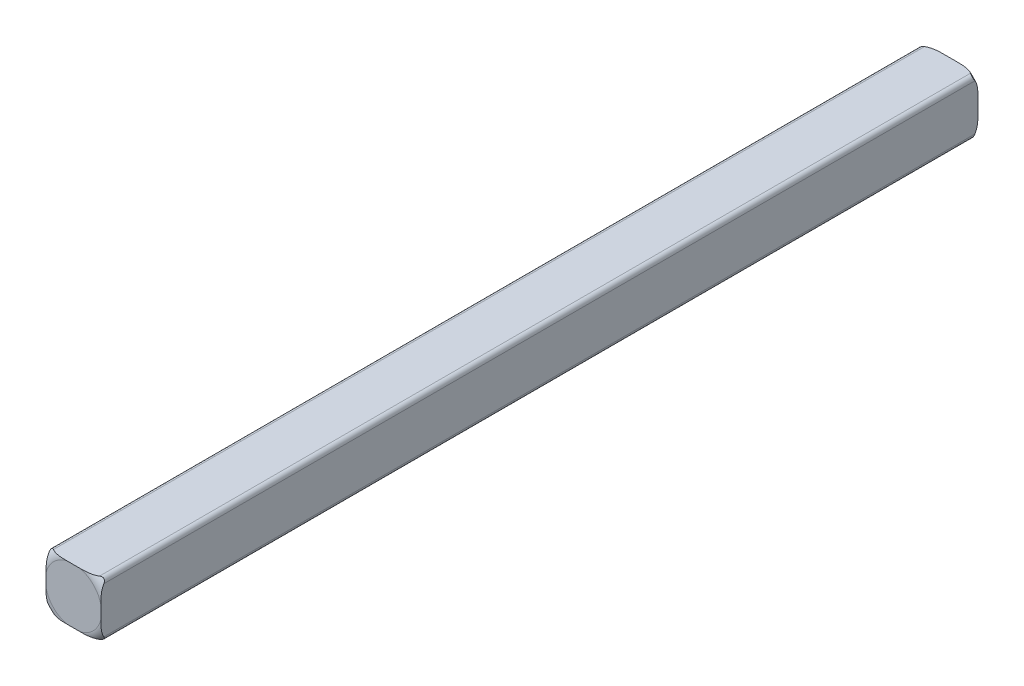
SolidWorks part; units mm, degrees
ref_plane "Front Plane" through (0, 0, 0) normal (0, 0, 1) x (1, 0, 0)
ref_plane "Top Plane" through (0, 0, 0) normal (0, 1, 0) x (1, 0, 0)
ref_plane "Right Plane" through (0, 0, 0) normal (1, 0, 0) x (0, 0, -1)
imported_body "Imported3"
fillet "Fillet1" radius 0.254
